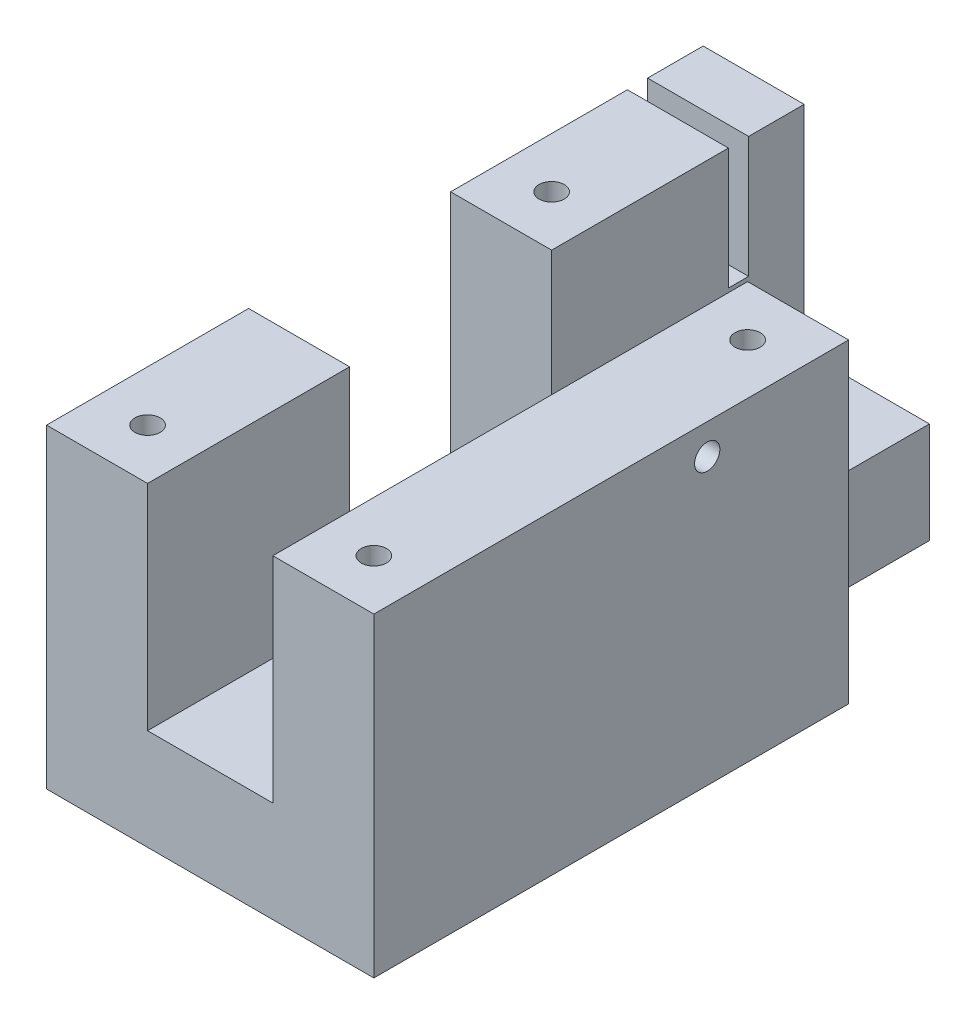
SolidWorks part; units mm, degrees
ref_plane "前视基准面" through (0, 0, 0) normal (0, 0, 1) x (1, 0, 0)
ref_plane "上视基准面" through (0, 0, 0) normal (0, 1, 0) x (1, 0, 0)
ref_plane "右视基准面" through (0, 0, 0) normal (1, 0, 0) x (0, 0, -1)
sketch "草图1" plane through (0, 0, 0) normal (0, 0, 1) x (1, 0, 0)
  line L0 (10, 10) -> (22.4, 10)
  line L1 (0, 0) -> (32.4, 0)
  line L2 (22.4, 10) -> (22.4, 31.2)
  line L3 (10, 10) -> (10, 31.2)
  line L4 (0, 0) -> (0, 31.2)
  line L5 (32.4, 0) -> (32.4, 31.2)
  line L6 (0, 31.2) -> (10, 31.2)
  line L7 (22.4, 31.2) -> (32.4, 31.2)
extrude "凸台-拉伸1" add sketch "草图1" along normal blind 65
sketch "草图2" plane through (32.4, 0, 0) normal (1, 0, 0) x (0, 0, -1)
  line L0 (0, 0) -> (0, 31.2)
  line L1 (-65, 0) -> (0, 0)
  line L2 (-65, 31.2) -> (-7.5, 31.2)
  line L3 (-65, 0) -> (-65, 31.2)
  line L4 (-7.5, 19.2) -> (-5.5, 19.2)
  line L5 (-5.5, 31.2) -> (-5.5, 19.2)
  line L6 (-7.5, 31.2) -> (-7.5, 19.2)
  line L7 (-5.5, 31.2) -> (0, 31.2)
  circle A0 centre (-32, 28.2) radius 1.25
extrude "切除-拉伸1" cut sketch "草图2" against normal blind 57.5 flip side to cut
sketch "草图3" plane through (0, 31.2, 0) normal (0, 1, 0) x (1, 0, 0)
  line L0 (10, -45) -> (10, -25)
  line L1 (22.4, -18) -> (22.4, 0)
  line L2 (0, -65) -> (0, -45)
  line L3 (32.4, -65) -> (32.4, -18)
  line L4 (0, -65) -> (32.4, -65)
  line L5 (0, -45) -> (10, -45)
  line L6 (0, -25) -> (10, -25)
  line L7 (0, 0) -> (22.4, 0)
  line L8 (0, -25) -> (0, 0)
  line L9 (22.4, -18) -> (32.4, -18)
extrude "切除-拉伸2" cut sketch "草图3" against normal blind 57.5 flip side to cut
sketch "草图4" plane through (0, 31.2, 0) normal (0, 1, 0) x (1, 0, 0)
  circle A0 centre (27.4, -23) radius 1.25
  circle A1 centre (27.4, -60) radius 1.25
  circle A2 centre (5, -60) radius 1.25
  circle A3 centre (5, -20) radius 1.25
extrude "切除-拉伸3" cut sketch "草图4" against normal blind 12
sketch "草图5" plane through (0, 31.2, 0) normal (0, 1, 0) x (1, 0, 0)
  circle A0 centre (5, -50) radius 2.1 construction
  circle A1 centre (27.4, -50) radius 2.1 construction
sketch "草图6" plane through (0, 0, 0) normal (0, -1, 0) x (1, 0, 0)
  circle A0 centre (5, 50) radius 2.1
  circle A1 centre (27.4, 50) radius 2.1
extrude "切除-拉伸4" cut sketch "草图6" against normal blind 12
